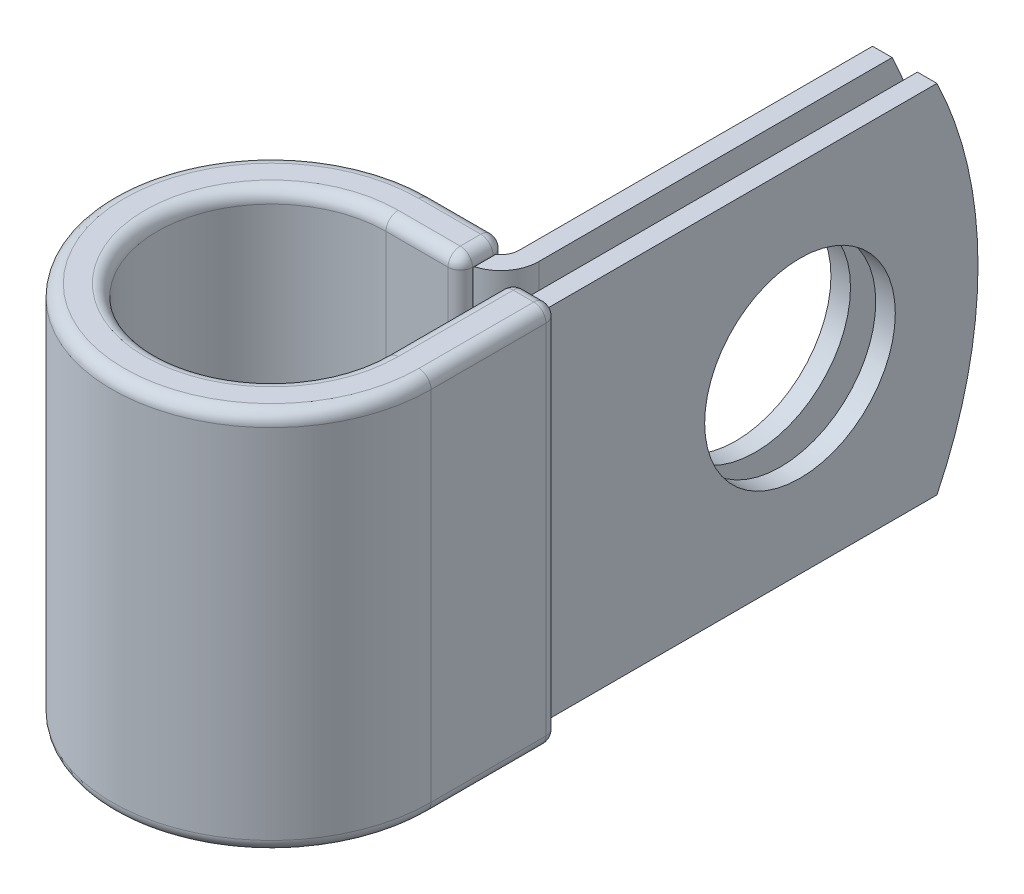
SolidWorks part; units mm, degrees
ref_plane "Front Plane" through (0, 0, 0) normal (0, 0, 1) x (1, 0, 0)
ref_plane "Top Plane" through (0, 0, 0) normal (0, 1, 0) x (1, 0, 0)
ref_plane "Right Plane" through (0, 0, 0) normal (1, 0, 0) x (0, 0, -1)
sketch "Sketch1" plane through (0, 0, 0) normal (0, 1, 0) x (1, 0, 0)
  line L0 (0, 7.9311) -> (3.9789, 7.9312)
  line L1 (7.9311, 0) -> (7.9311, 7.9312)
  line L2 (6.3563, 34.8996) -> (6.3564, 10.3086)
  line L5 (7.9311, 7.9312) -> (7.9311, 34.8996)
  arc A0 (0, 7.9311) -> (7.9311, 0) centre (0, 0) ccw
  arc A3 (3.9789, 7.9312) -> (6.3564, 10.3086) centre (3.9789, 10.3086) ccw
extrude "Extrude-Thin1" add sketch "Sketch1" along normal mid plane 22.225 thin
sketch "Sketch2" plane through (5.1372, 0, 0) normal (-1, 0, 0) x (0, 0, 1)
  line L0 (-34.8996, 11.1125) -> (-34.8996, -11.1125) construction
  line L7 (0, 11.1125) -> (0, -11.1125) construction
  circle A0 centre (-23.7998, 0) radius 5.9436
  point P2 (-34.8996, 0)
extrude "Cut-Extrude1" cut sketch "Sketch2" against normal up to surface (1.2192 mm away)
sketch "Sketch3" plane through (9.1503, 0, 0) normal (1, 0, 0) x (0, 0, -1)
  line L0 (34.8996, 11.1125) -> (34.8996, -11.1125) construction
  circle A0 centre (23.7998, 0) radius 5.9436
  point P3 (34.8996, 0)
extrude "Cut-Extrude2" cut sketch "Sketch3" against normal up to surface (1.2192 mm away)
sketch "Sketch4" plane through (5.1372, 0, 0) normal (-1, 0, 0) x (0, 0, 1)
  line L0 (-34.8996, 11.1125) -> (-34.8996, -11.1125)
  line L1 (-34.8996, 11.1125) -> (-32.3397, 11.1125)
  line L2 (-34.8996, 11.1125) -> (-10.3086, 11.1125) construction
  line L3 (-34.8996, -11.1125) -> (-32.3397, -11.1125)
  line L4 (-34.8996, -11.1125) -> (-10.3086, -11.1125) construction
  arc A0 (-32.3397, 11.1125) -> (-32.3397, -11.1125) centre (-9.4996, 0) ccw
extrude "Cut-Extrude3" cut sketch "Sketch4" against normal through all contours A0 M4 M5 | A0 L0 M2
ref_plane "Plane1" through (0, 0, -7.9311) normal (0, 0, 1) x (1, 0, 0)
ref_plane "Plane2" through (0, 0, 0) normal (-1, 0, 0) x (0, 0, 1)
sketch "Sketch5" plane through (0, 0, -7.9311) normal (0, 0, 1) x (1, 0, 0)
  line L0 (7.9312, 11.1125) -> (9.1504, 11.1125)
  line L1 (7.9312, -11.1125) -> (7.9312, 11.1125)
  line L2 (7.1374, -11.1442) -> (7.1374, 11.1442)
  line L3 (9.1504, 11.1125) -> (9.1504, -11.1125)
  line L4 (9.1504, -11.1125) -> (7.9312, -11.1125)
  line L5 (7.8994, 11.9062) -> (9.1821, 11.9062)
  line L7 (9.9441, 11.1442) -> (9.9441, -11.1442)
  line L8 (9.1821, -11.9062) -> (7.8994, -11.9062)
  line L9 (7.1374, -11.9062) -> (7.1374, 11.9062) construction
  line L11 (9.9441, -11.9062) -> (7.1374, -11.9062) construction
  line L12 (9.9441, 11.9062) -> (9.9441, -11.9062) construction
  line L13 (7.1374, 11.9062) -> (9.9441, 11.9062) construction
  arc A0 (7.1374, -11.1442) -> (7.8994, -11.9062) centre (7.8994, -11.1442) ccw
  arc A1 (9.9441, -11.1442) -> (9.1821, -11.9062) centre (9.1821, -11.1442) cw
  arc A2 (9.1821, 11.9062) -> (9.9441, 11.1442) centre (9.1821, 11.1442) cw
  arc A3 (7.1374, 11.1442) -> (7.8994, 11.9062) centre (7.8994, 11.1442) cw
sketch "Sketch6" plane through (0, 11.1125, 0) normal (0, 1, 0) x (1, 0, 0)
  line L0 (7.1374, 0) -> (7.1374, 7.9312)
  line L1 (0, 7.1374) -> (4.6292, 7.1374)
  line L2 (5.1372, 32.3397) -> (5.1372, 10.3086) construction
  arc A0 (0, 7.1374) -> (7.1374, 0) centre (0, 0) ccw
sweep "Sweep1" add profiles "Sketch5" path "Sketch6"
fillet "Fillet1" radius 0.762 16 edges at (4.6292, 11.6831, -9.7209) (4.6292, 0, -9.9441) (4.6292, -11.6831, -9.7209) (4.6292, -11.9062, -8.5408) (4.6292, -11.6831, -7.3606) (4.6292, 0, -7.1374) (4.6292, 11.6831, -7.3606) (9.7209, 11.6831, -7.9311) (9.9441, 0, -7.9311) (9.7209, -11.6831, -7.9311) (8.5407, -11.9062, -7.9311) (7.3606, -11.6831, -7.9311) (7.1374, 0, -7.9311) (7.3606, 11.6831, -7.9311) (4.6292, 11.9062, -8.5407) (8.5407, 11.9062, -7.9311)
equation "\"D4@Sketch5\"=\"D1@Extrude-Thin1\""
equation "\"D5@Sketch5\"=\"D5@Extrude-Thin1\""
equation "\"D1@Sketch3\"=\"D2@Sketch2\""
equation "\"D7@Sketch1\"=\"D3@Sketch2\" + \"D1@Sketch3\""
equation "\"D1@Sketch1\"=\"D1@Sketch6\" + 2 * \"D3@Sketch5\""
equation "\"D1@Sketch4\"=( \"D1@Extrude-Thin1\" + .125 ) * 2"
equation "\"D2@Sketch1\"=1.95*\"D5@Extrude-Thin1\""
equation "\"D2@Sketch3\"=\"D1@Sketch2\""
